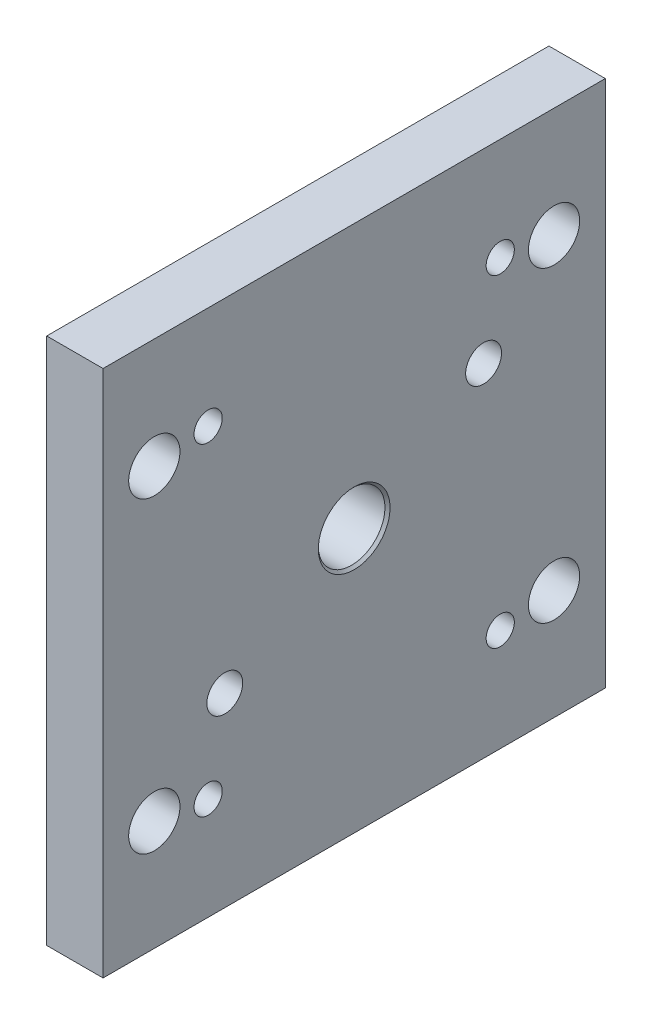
SolidWorks part; units mm, degrees
ref_plane "Plan de face" through (0, 0, 0) normal (0, 0, 1) x (1, 0, 0)
ref_plane "Plan de dessus" through (0, 0, 0) normal (0, 1, 0) x (1, 0, 0)
ref_plane "Plan de droite" through (0, 0, 0) normal (1, 0, 0) x (0, 0, -1)
imported_body "Importée1"
hole_wizard "Chambrage pour vis à tête hexagonale M102" positions "Esquisse3D1" profile "Esquisse3" counterbore size "M10" standard "ISO"
sketch3d "Esquisse3D1"
  line L0 (-22, 30.5, -50.5) -> (-22, 30.5, 50.5) construction
  line L1 (-22, 30.5, 50.5) -> (-22, -30.5, 50.5) construction
  line L3 (-22, 0, -98) -> (-22, 0, 50.5) construction
  line L4 (-22, -103, -98) -> (-22, 103, -98) construction
  line L5 (-22, 103, 0) -> (-22, 30.5, 0) construction
  line L6 (-22, 103, 98) -> (-22, 103, -98) construction
  point P0 (-22, 30.5, -50.5)
  point P2 (-22, -30.5, 50.5)
  dimension "D1" = 101
  dimension "D2" = 61
sketch "Esquisse3" plane through (-22, 30.5, -50.5) normal (0, 1, 0) x (0, 0, 1)
  line L0 (0, 0) -> (0, 22)
  line L1 (0, 22) -> (7, 22)
  line L3 (7, 22) -> (7, 5)
  line L4 (7, 5) -> (9, 5)
  line L5 (9, 5) -> (9, 0)
  line L7 (9, 0) -> (0, 0)
  line L11 (0, -6.35) -> (0, 107.95) construction
  dimension "Diamètre du perçage jusqu'au prochain" = 14
  dimension "Profondeur du perçage jusqu'au prochain" = 22
  dimension "Diamètre du chambrage" = 18
  dimension "Profondeur du chambrage" = 5
sketch "Esquisse4" plane through (0, 0, 0) normal (1, 0, 0) x (0, 0, -1)
  circle A0 centre (0, 0) radius 13
  dimension "D1" = 26
extrude "Extrusion1" cut sketch "Esquisse4" against normal through all
chamfer "Chanfrein1" distance 1 angle 45 2 edges at (0, 13, 0) (-22, 13, 0)
